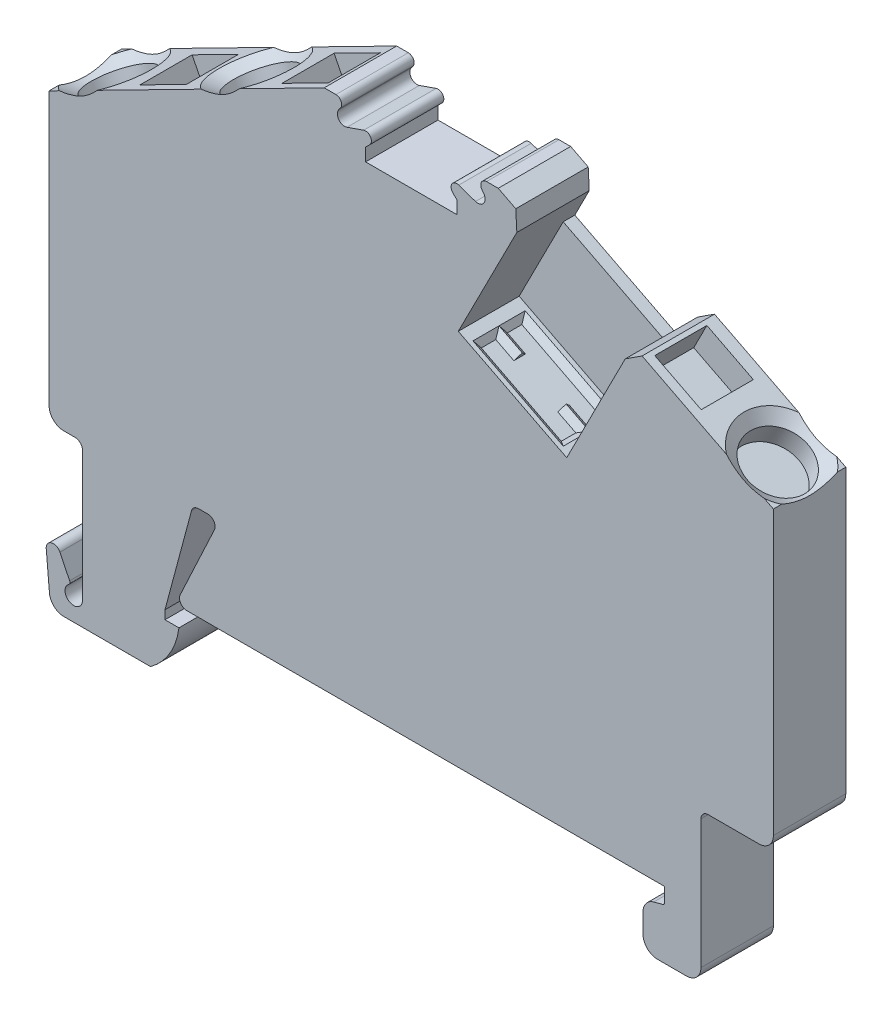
SolidWorks part; units mm, degrees
ref_plane "Front Plane" through (0, 0, 0) normal (0, 0, 1) x (1, 0, 0)
ref_plane "Top Plane" through (0, 0, 0) normal (0, 1, 0) x (1, 0, 0)
ref_plane "Right Plane" through (0, 0, 0) normal (1, 0, 0) x (0, 0, -1)
ref_plane "Plane1" through (0, 0, 0) normal (0, 0, 1) x (1, 0, 0)
sketch "Sketch1" plane through (0, 0, 0) normal (0, 0, 1) x (1, 0, 0)
  line L0 (-25, 10) -> (25, 10)
  line L1 (25, 10) -> (25, 26.3222)
  line L2 (25, 26.3222) -> (15.9365, 30.9403)
  line L3 (15.9365, 30.9403) -> (14.7744, 30.1856)
  line L4 (14.7744, 30.1856) -> (10.7339, 22.2557)
  line L5 (10.7339, 22.2557) -> (3.2494, 26.0692)
  line L6 (3.2494, 26.0692) -> (7.2899, 33.9992)
  line L7 (7.2899, 33.9992) -> (7.2174, 35.3829)
  line L8 (7.2174, 35.3829) -> (6.0063, 36)
  line L9 (6.0063, 36) -> (5.2, 36)
  line L10 (4.88, 35.36) -> (5, 35.2)
  line L11 (4.4363, 34.4276) -> (3.281, 34.8279)
  line L12 (2.8672, 34.1672) -> (3.15, 33.8843)
  line L13 (3.15, 33.8843) -> (3.15, 33)
  line L14 (3.15, 33) -> (-3.15, 33)
  line L15 (-3.15, 33) -> (-3.15, 33.8843)
  line L16 (-3.15, 33.8843) -> (-2.8672, 34.1672)
  line L17 (-3.281, 34.8279) -> (-4.4363, 34.4276)
  line L18 (-5, 35.2) -> (-4.88, 35.36)
  line L19 (-5.2, 36) -> (-6.0063, 36)
  line L20 (-6.0063, 36) -> (-25, 26.3222)
  line L21 (-25, 26.3222) -> (-25, 10)
  arc A0 (5.2, 36) -> (4.88, 35.36) centre (5.2, 35.6) ccw
  arc A1 (5, 35.2) -> (4.4363, 34.4276) centre (4.6, 34.9) cw
  arc A2 (3.281, 34.8279) -> (2.8672, 34.1672) centre (3.15, 34.45) ccw
  arc A3 (-2.8672, 34.1672) -> (-3.281, 34.8279) centre (-3.15, 34.45) ccw
  arc A4 (-4.4363, 34.4276) -> (-5, 35.2) centre (-4.6, 34.9) cw
  arc A5 (-4.88, 35.36) -> (-5.2, 36) centre (-5.2, 35.6) ccw
extrude "Boss-Extrude1" add sketch "Sketch1" along normal blind 5
ref_plane "Plane2" through (0, 0, 0) normal (0, 0, 1) x (1, 0, 0)
sketch "Sketch2" plane through (0, 0, 0) normal (0, 0, 1) x (1, 0, 0)
  line L0 (-25.1981, -1.1436) -> (-24.9756, -3.6872)
  line L1 (-23.9794, -4.6) -> (-18.0018, -4.6)
  line L2 (-16.0376, -1.3) -> (-17, -1.3)
  line L3 (-17, -1.3) -> (-17, -0.7)
  line L4 (-17, -0.7) -> (-15.1701, 6.1294)
  line L5 (-14.6871, 6.5) -> (-14.0387, 6.5)
  line L6 (-13.5855, 5.7887) -> (-15.9532, 0.7113)
  line L7 (-15.5, 0) -> (17.5, 0)
  line L8 (17.5, 0) -> (17.5, -0.9465)
  line L9 (17.3518, -1.1397) -> (16.7412, -1.3033)
  line L10 (16, -2.2693) -> (16, -3.6)
  line L11 (17, -4.6) -> (19, -4.6)
  line L12 (20, -3.6) -> (20, 5.3)
  line L13 (20.5, 5.8) -> (24, 5.8)
  line L14 (25, 6.8) -> (25, 10)
  line L15 (25, 10) -> (-25, 10)
  line L16 (-25, 10) -> (-25, 7.5)
  line L17 (-24, 6.5) -> (-23.2, 6.5)
  line L18 (-22.7, 6) -> (-22.7, -3)
  line L19 (-23.5837, -2.2611) -> (-24.2498, -0.8825)
  arc A0 (-24.2498, -0.8825) -> (-25.1981, -1.1436) centre (-24.7, -1.1) ccw
  arc A1 (-24.9756, -3.6872) -> (-23.9794, -4.6) centre (-23.9794, -3.6) ccw
  arc A2 (-18.0018, -4.6) -> (-16.0376, -1.3) centre (-20.8, -0.7) ccw
  arc A3 (-15.1701, 6.1294) -> (-14.6871, 6.5) centre (-14.6871, 6) cw
  arc A4 (-14.0387, 6.5) -> (-13.5855, 5.7887) centre (-14.0387, 6) cw
  arc A5 (-15.9532, 0.7113) -> (-15.5, 0) centre (-15.5, 0.5) ccw
  arc A6 (17.5, -0.9465) -> (17.3518, -1.1397) centre (17.3, -0.9465) cw
  arc A7 (16.7412, -1.3033) -> (16, -2.2693) centre (17, -2.2693) ccw
  arc A8 (16, -3.6) -> (17, -4.6) centre (17, -3.6) ccw
  arc A9 (19, -4.6) -> (20, -3.6) centre (19, -3.6) ccw
  arc A10 (20, 5.3) -> (20.5, 5.8) centre (20.5, 5.3) cw
  arc A11 (24, 5.8) -> (25, 6.8) centre (24, 6.8) ccw
  arc A12 (-25, 7.5) -> (-24, 6.5) centre (-24, 7.5) ccw
  arc A13 (-23.2, 6.5) -> (-22.7, 6) centre (-23.2, 6) cw
  arc A14 (-22.7, -3) -> (-23.6478, -2.5111) centre (-23.3, -3) cw
  arc A15 (-23.6478, -2.5111) -> (-23.5837, -2.2611) centre (-23.7638, -2.3481) ccw
extrude "Boss-Extrude2" add sketch "Sketch2" along normal blind 5
ref_plane "Plane3" through (0, 0, 0) normal (0, 0, 1) x (1, 0, 0)
sketch "Sketch3" plane through (0, 0, 0) normal (0, 0, 1) x (1, 0, 0)
  line L0 (3.2494, 26.0692) -> (10.7339, 22.2557)
  line L1 (10.7339, 22.2557) -> (13.7756, 28.2254)
  line L2 (13.7756, 28.2254) -> (6.2912, 32.0389)
  line L3 (6.2912, 32.0389) -> (3.2494, 26.0692)
extrude "Boss-Extrude3" add sketch "Sketch3" along normal blind 0.8
ref_plane "Plane4" through (0, 0, 2.5) normal (0, 0, 1) x (1, 0, 0)
sketch "Sketch4" plane through (0, 0, 2.5) normal (0, 0, 1) x (1, 0, 0)
  line L0 (-13.1808, 32.3444) -> (-10.5969, 33.661)
  line L1 (-10.5969, 33.661) -> (-11.0373, 32.7632)
  line L2 (-11.0373, 32.7632) -> (-10.4017, 31.5158)
  line L3 (-10.4017, 31.5158) -> (-12.2728, 30.5624)
  line L4 (-12.2728, 30.5624) -> (-13.1808, 32.3444)
  line L5 (-12.2728, 30.5624) -> (-13.1808, 32.3444) construction
revolve "Cut-Revolve1" cut sketch "Sketch4" angle 360 about L5
ref_plane "Plane5" through (0, 0, 2.5) normal (0, 0, 1) x (1, 0, 0)
sketch "Sketch5" plane through (0, 0, 2.5) normal (0, 0, 1) x (1, 0, 0)
  line L0 (-22.9818, 27.3505) -> (-20.3979, 28.6671)
  line L1 (-20.3979, 28.6671) -> (-20.8383, 27.7693)
  line L2 (-20.8383, 27.7693) -> (-20.2027, 26.5219)
  line L3 (-20.2027, 26.5219) -> (-22.0739, 25.5685)
  line L4 (-22.0739, 25.5685) -> (-22.9818, 27.3505)
  line L5 (-22.0739, 25.5685) -> (-22.9818, 27.3505) construction
revolve "Cut-Revolve2" cut sketch "Sketch5" angle 360 about L5
ref_plane "Plane6" through (0, 0, 2.5) normal (0, 0, 1) x (1, 0, 0)
sketch "Sketch6" plane through (0, 0, 2.5) normal (0, 0, 1) x (1, 0, 0)
  line L0 (23.0709, 27.3051) -> (25.6549, 25.9885)
  line L1 (25.6549, 25.9885) -> (24.6697, 25.8171)
  line L2 (24.6697, 25.8171) -> (24.0341, 24.5697)
  line L3 (24.0341, 24.5697) -> (22.163, 25.5231)
  line L4 (22.163, 25.5231) -> (23.0709, 27.3051)
  line L5 (22.163, 25.5231) -> (23.0709, 27.3051) construction
revolve "Cut-Revolve3" cut sketch "Sketch6" angle 360 about L5
ref_plane "Plane7" through (0, 0, 0.8) normal (0, 0, 1) x (1, 0, 0)
sketch "Sketch7" plane through (0, 0, 0.8) normal (0, 0, 1) x (1, 0, 0)
  line L0 (-9.5276, 34.2058) -> (-8.6197, 32.4238)
  line L1 (-8.6197, 32.4238) -> (-5.412, 34.0581)
  line L2 (-5.412, 34.0581) -> (-6.32, 35.8401)
  line L3 (-6.32, 35.8401) -> (-9.5276, 34.2058)
extrude "Cut-Extrude1" cut sketch "Sketch7" along normal blind 3.6
ref_plane "Plane8" through (0, 0, 0.8) normal (0, 0, 1) x (1, 0, 0)
sketch "Sketch8" plane through (0, 0, 0.8) normal (0, 0, 1) x (1, 0, 0)
  line L0 (-19.3287, 29.2119) -> (-18.4207, 27.4299)
  line L1 (-18.4207, 27.4299) -> (-15.2131, 29.0642)
  line L2 (-15.2131, 29.0642) -> (-16.1211, 30.8462)
  line L3 (-16.1211, 30.8462) -> (-19.3287, 29.2119)
extrude "Cut-Extrude2" cut sketch "Sketch8" along normal blind 3.6
ref_plane "Plane9" through (0, 0, 0.8) normal (0, 0, 1) x (1, 0, 0)
sketch "Sketch9" plane through (0, 0, 0.8) normal (0, 0, 1) x (1, 0, 0)
  line L0 (15.3022, 29.0188) -> (18.5098, 27.3845)
  line L1 (18.5098, 27.3845) -> (19.4178, 29.1665)
  line L2 (19.4178, 29.1665) -> (16.2102, 30.8008)
  line L3 (16.2102, 30.8008) -> (15.3022, 29.0188)
extrude "Cut-Extrude3" cut sketch "Sketch9" along normal blind 3.6
ref_plane "Plane10" through (-4.1342, 2.1065, 0) normal (0.891, -0.454, 0) x (0, 0, -1)
sketch "Sketch10" plane through (-4.1342, 2.1065, 0) normal (0.891, -0.454, 0) x (0, 0, -1)
  line L0 (-4.7, 25.203) -> (-4.7, 24.703)
  line L1 (-4.7, 24.703) -> (-4.3, 24.303)
  line L2 (-4.3, 24.303) -> (-3.3, 24.303)
  line L3 (-3.3, 24.303) -> (-2.9, 24.703)
  line L4 (-2.9, 24.703) -> (-2.5, 24.303)
  line L5 (-2.5, 24.303) -> (-1.5, 24.303)
  line L6 (-1.5, 24.303) -> (-1.1, 24.703)
  line L7 (-1.1, 24.703) -> (-1.1, 25.203)
  line L8 (-1.1, 25.203) -> (-4.7, 25.203)
extrude "Cut-Extrude4" cut sketch "Sketch10" against normal blind 3.5 and the other way blind 3.5
ref_plane "Plane11" through (-4.1342, 2.1065, 0) normal (0.891, -0.454, 0) x (0, 0, -1)
sketch "Sketch11" plane through (-4.1342, 2.1065, 0) normal (0.891, -0.454, 0) x (0, 0, -1)
  line L0 (-2.4, 24.703) -> (-3.4, 24.703)
  line L1 (-3.4, 24.703) -> (-3.4, 24.303)
  line L2 (-3.4, 24.303) -> (-2.4, 24.303)
  line L3 (-2.4, 24.303) -> (-2.4, 24.703)
extrude "Cut-Extrude5" cut sketch "Sketch11" against normal blind 1.7 and the other way blind 1.7
ref_plane "Plane12" through (0, 0, 0) normal (0, 0, 1) x (1, 0, 0)
sketch "Sketch12" plane through (0, 0, 0) normal (0, 0, 1) x (1, 0, 0)
  line L0 (3.5082, 24.815) -> (9.7453, 21.6371)
  line L1 (9.7453, 21.6371) -> (10.1993, 22.5281)
  line L2 (10.1993, 22.5281) -> (9.6613, 22.3533)
  line L3 (9.6613, 22.3533) -> (4.137, 25.168)
  line L4 (4.137, 25.168) -> (3.9622, 25.706)
  line L5 (3.9622, 25.706) -> (3.5082, 24.815)
extrude "Boss-Extrude4" add sketch "Sketch12" along normal blind 5
